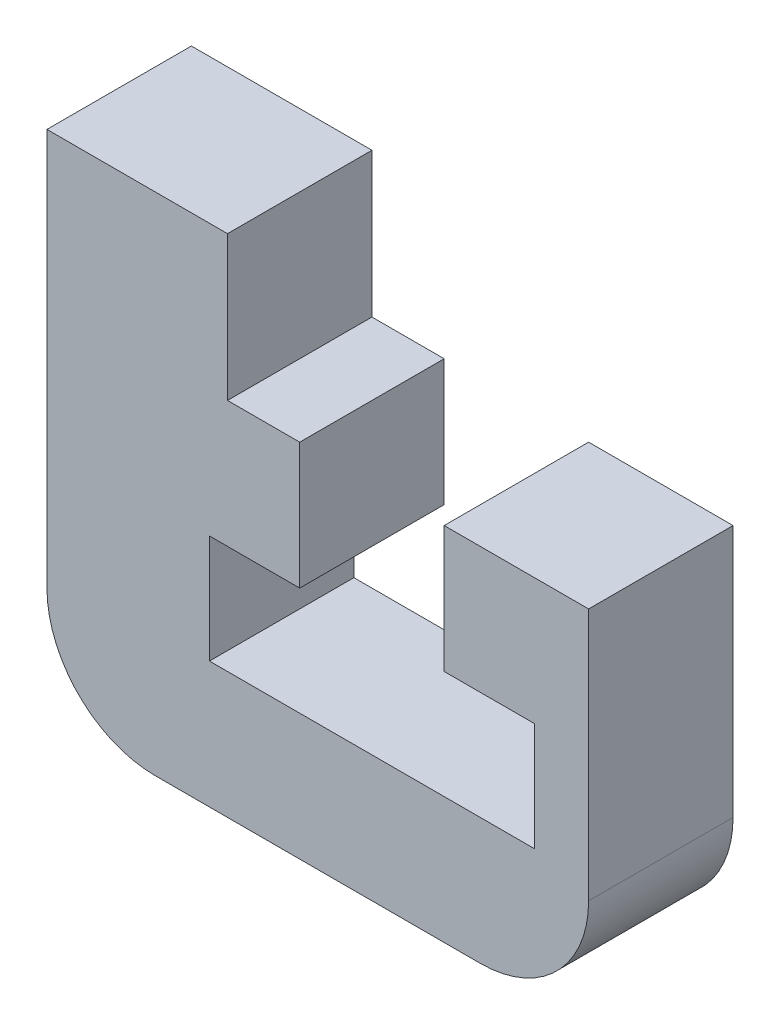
SolidWorks part; units mm, degrees
ref_plane "Alzado" through (0, 0, 0) normal (0, 0, 1) x (1, 0, 0)
ref_plane "Planta" through (0, 0, 0) normal (0, 1, 0) x (1, 0, 0)
ref_plane "Vista lateral" through (0, 0, 0) normal (1, 0, 0) x (0, 0, -1)
sketch "Croquis1" plane through (0, 0, 0) normal (0, 0, 1) x (1, 0, 0)
  line L0 (0, 23.001) -> (-5, 23.001)
  line L1 (-5, 23.001) -> (-5, 12.001)
  line L2 (6, 19.001) -> (10, 19.001)
  line L3 (10, 19.001) -> (10, 12.001)
  line L4 (6, 19.001) -> (6, 15.501)
  line L5 (6, 15.501) -> (8.5, 15.501)
  line L6 (8.5, 15.501) -> (8.5, 12.501)
  line L7 (8.5, 12.501) -> (-0.5, 12.501)
  line L8 (-0.5, 12.501) -> (-0.5, 15.501)
  line L9 (-0.5, 15.501) -> (2, 15.501)
  line L10 (2, 15.501) -> (2, 19.001)
  line L11 (2, 19.001) -> (0, 19.001)
  line L12 (0, 19.001) -> (0, 23.001)
  line L13 (7, 9.001) -> (-2, 9.001)
  arc A0 (-5, 12.001) -> (-2, 9.001) centre (-2, 12.001) ccw
  arc A1 (10, 12.001) -> (7, 9.001) centre (7, 12.001) cw
  dimension "D1" = 3
  dimension "D2" = 3
extrude "Saliente-Extruir1" add sketch "Croquis1" along normal blind 4
